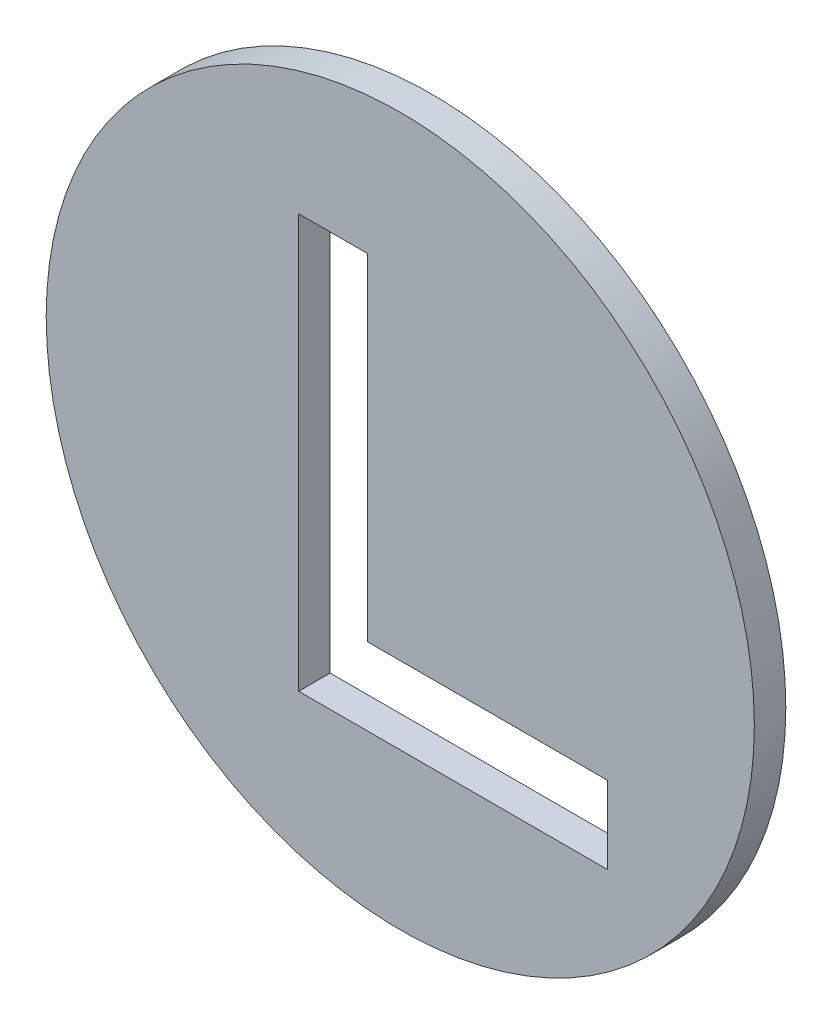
SolidWorks part; units mm, degrees
ref_plane "Front Plane" through (0, 0, 0) normal (0, 0, 1) x (1, 0, 0)
ref_plane "Top Plane" through (0, 0, 0) normal (0, 1, 0) x (1, 0, 0)
ref_plane "Right Plane" through (0, 0, 0) normal (1, 0, 0) x (0, 0, -1)
sketch "Sketch1" plane through (0, 0, 0) normal (0, 0, 1) x (1, 0, 0)
  circle A0 centre (0, 0) radius 45
  dimension "D1" = 90
extrude "Boss-Extrude1" add sketch "Sketch1" along normal blind 4
sketch "Sketch2" plane through (0, 0, 4) normal (0, 0, 1) x (1, 0, 0)
  line L0 (-12.9109, 27.3675) -> (-12.9109, -25.1854)
  line L1 (-12.9109, -25.1854) -> (26.3674, -25.1854)
  line L2 (26.3674, -25.1854) -> (26.3674, -15.3658)
  line L3 (26.3674, -15.3658) -> (-4.1824, -15.3658)
  line L4 (-4.1824, -15.3658) -> (-4.1824, 27.3675)
  line L5 (-4.1824, 27.3675) -> (-12.9109, 27.3675)
extrude "Cut-Extrude1" cut sketch "Sketch2" against normal blind 4
